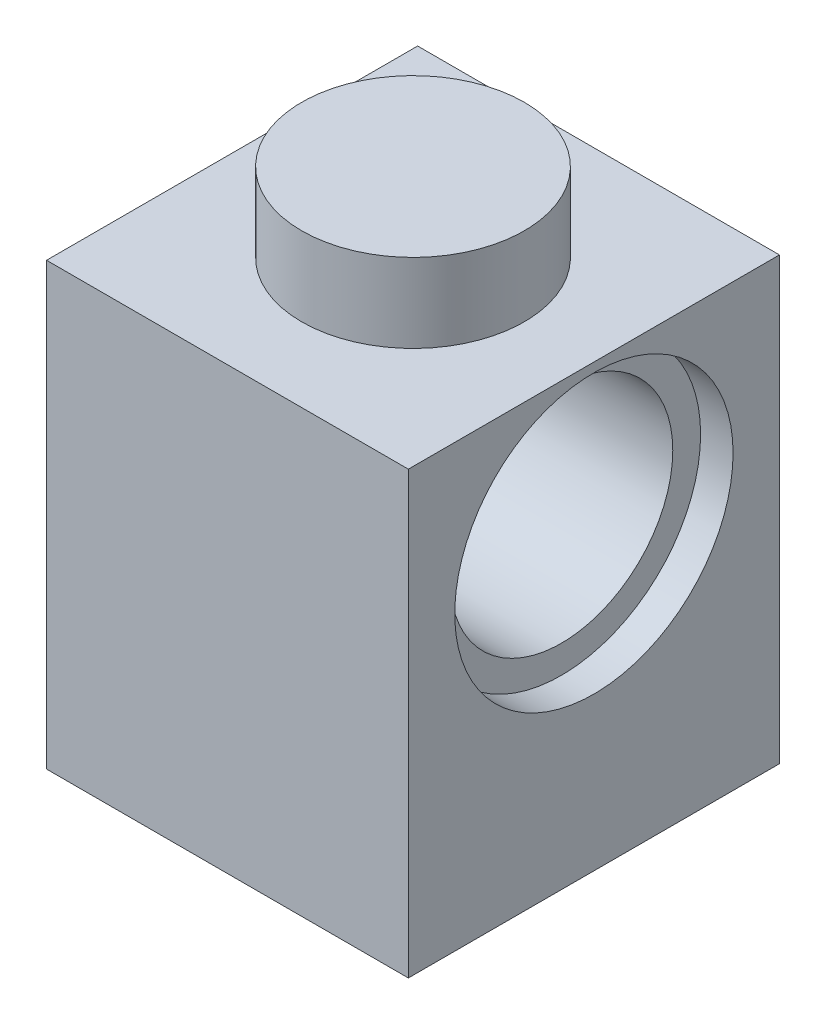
SolidWorks part; units mm, degrees
ref_plane "Front Plane" through (0, 0, 0) normal (0, 0, 1) x (1, 0, 0)
ref_plane "Top Plane" through (0, 0, 0) normal (0, 1, 0) x (1, 0, 0)
ref_plane "Right Plane" through (0, 0, 0) normal (1, 0, 0) x (0, 0, -1)
sketch "Sketch1" plane through (0, 0, 0) normal (0, 1, 0) x (1, 0, 0)
  line L1 (3.9, -4) -> (-3.9, -4)
  line L2 (3.9, -4) -> (3.9, 4)
  line L3 (3.9, 4) -> (-3.9, 4)
  line L4 (-3.9, -4) -> (-3.9, 4)
  line L5 (3.9, -4) -> (-3.9, 4) construction
  line L6 (3.9, 4) -> (-3.9, -4) construction
  point P0 (0, 0)
  dimension "D1" = 7.8
  dimension "D2" = 8
extrude "Extrude1" add sketch "Sketch1" along normal blind 9.5
sketch "Sketch6" plane through (0, 0, 0) normal (0, -1, 0) x (1, 0, 0)
  line L0 (-3.9, 4) -> (3.9, 4) construction
  line L1 (2.45, -2.55) -> (-2.45, -2.55)
  line L2 (2.45, -2.55) -> (2.45, 2.55)
  line L3 (2.45, 2.55) -> (-2.45, 2.55)
  line L4 (-2.45, -2.55) -> (-2.45, 2.55)
  line L5 (2.45, -2.55) -> (-2.45, 2.55) construction
  line L6 (2.45, 2.55) -> (-2.45, -2.55) construction
  line L7 (3.9, 4) -> (3.9, -4) construction
  point P0 (0, 0)
  dimension "D1" = 1.45
  dimension "D2" = 1.45
extrude "Extrude8" cut sketch "Sketch6" against normal blind 2
sketch "Sketch7" plane through (0, 9.5, 0) normal (0, 1, 0) x (1, 0, 0)
  circle A0 centre (0, 0) radius 2.4
  dimension "D1" = 4.8
extrude "Extrude10" add sketch "Sketch7" along normal blind 1.7
sketch "Sketch8" plane through (3.9, 0, 0) normal (1, 0, 0) x (0, 0, -1)
  line L0 (0, 9.5) -> (0, 0) construction
  line L1 (-4, 9.5) -> (4, 9.5) construction
  line L2 (-4, 5.9) -> (5.7421, 5.9) construction
  line L3 (-4, 9.5) -> (-4, 0) construction
  circle A0 centre (0, 6.3) radius 3
  dimension "D2" = 6
  dimension "D1" = 3.6
extrude "Cut-Extrude1" cut sketch "Sketch8" against normal blind 0.7
sketch "Sketch9" plane through (-3.9, 0, 0) normal (-1, 0, 0) x (0, 0, 1)
  circle A0 centre (0, 6.3) radius 3
  dimension "D1" = 6
extrude "Cut-Extrude2" cut sketch "Sketch9" against normal blind 0.7
sketch "Sketch10" plane through (-3.9, 0, 0) normal (-1, 0, 0) x (0, 0, 1)
  circle A0 centre (0, 6.3) radius 2.4
  dimension "D1" = 4.8
extrude "Cut-Extrude3" cut sketch "Sketch10" against normal through all
